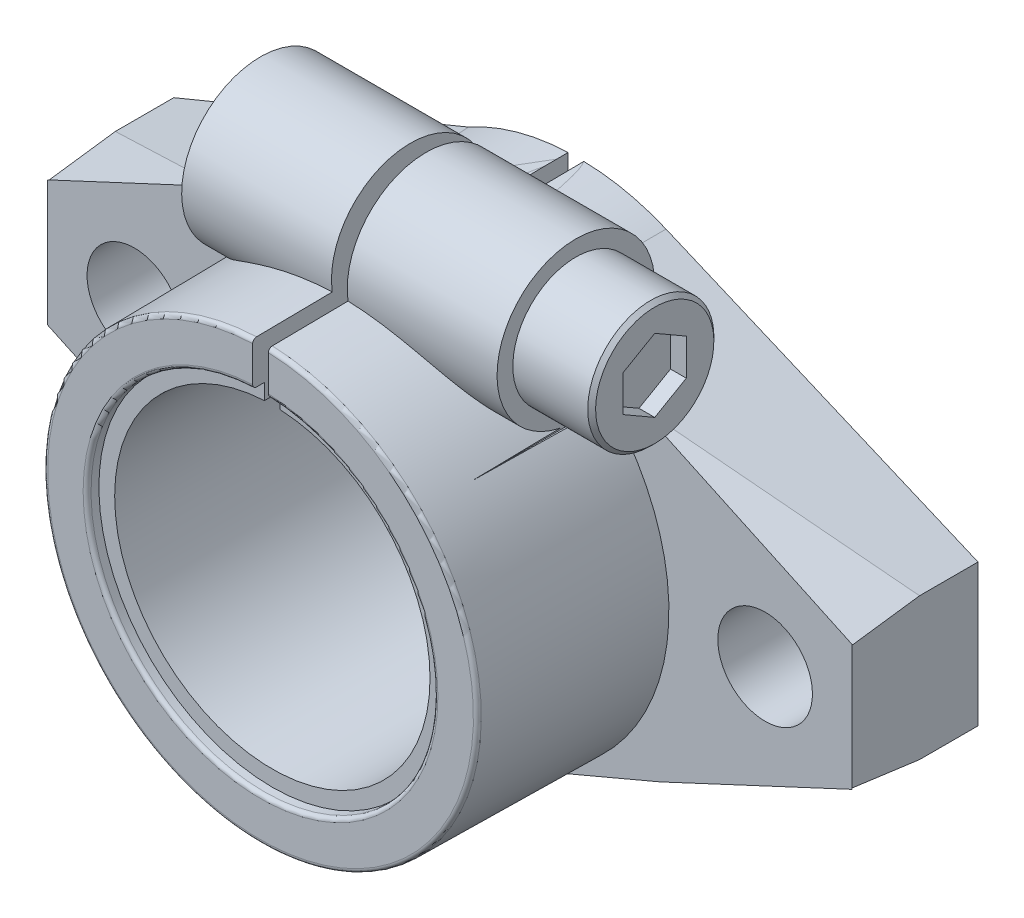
SolidWorks part; units mm, degrees
other "Solid1"
ref_plane "Front Plane" through (0, 0, 0) normal (0, 0, 1) x (1, 0, 0)
ref_plane "Top Plane" through (0, 0, 0) normal (0, 1, 0) x (1, 0, 0)
ref_plane "Right Plane" through (0, 0, 0) normal (1, 0, 0) x (0, 0, -1)
imported_body "2.7127 SHF40.stp<1>"
fillet "Fillet1" radius 0.5
